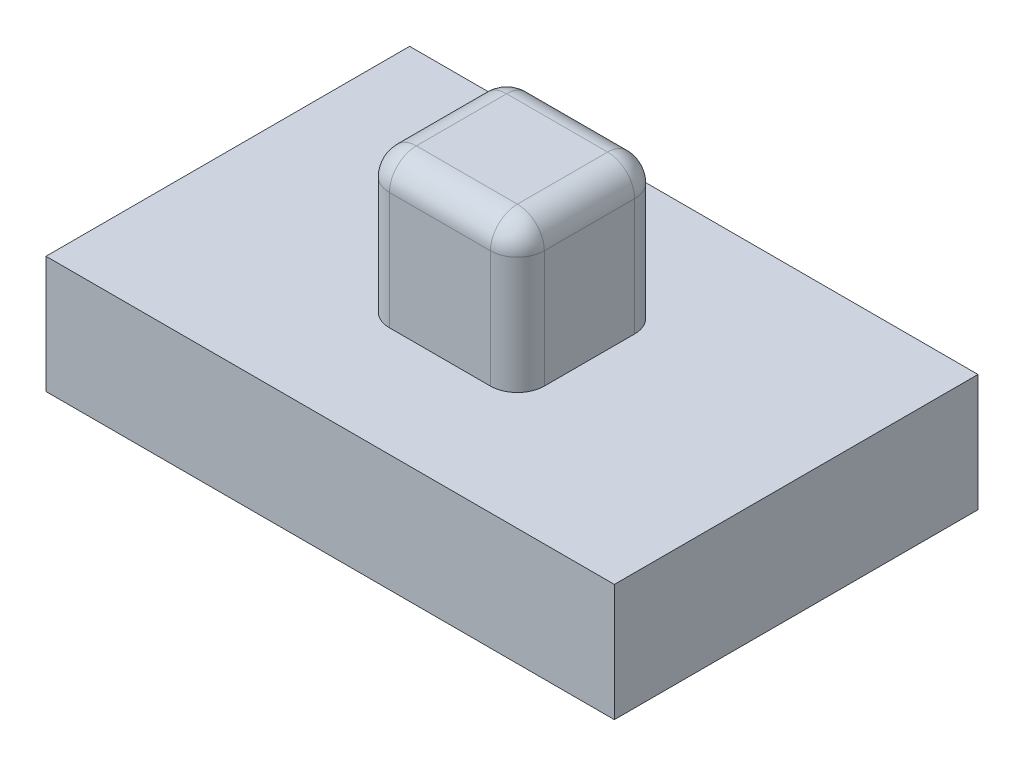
SolidWorks part; units mm, degrees
ref_plane "Front" through (0, 0, 0) normal (0, 0, 1) x (1, 0, 0)
ref_plane "Top" through (0, 0, 0) normal (0, 1, 0) x (1, 0, 0)
ref_plane "Right" through (0, 0, 0) normal (1, 0, 0) x (0, 0, -1)
sketch "Sketch1" plane through (0, 0, 0) normal (0, 1, 0) x (1, 0, 0)
  line L1 (-2.11, -1.35) -> (2.11, -1.35)
  line L2 (-2.11, -1.35) -> (-2.11, 1.35)
  line L3 (-2.11, 1.35) -> (2.11, 1.35)
  line L4 (2.11, -1.35) -> (2.11, 1.35)
  line L5 (-2.11, -1.35) -> (2.11, 1.35) construction
  line L6 (-2.11, 1.35) -> (2.11, -1.35) construction
  point P0 (0, 0)
  dimension "D1" = 4.22
  dimension "D2" = 2.7
extrude "Boss-Extrude1" add sketch "Sketch1" along normal blind 0.87
sketch "Sketch2" plane through (0, 0.87, 0) normal (0, 1, 0) x (1, 0, 0)
  line L1 (-0.575, -0.535) -> (0.575, -0.535)
  line L2 (-0.575, -0.535) -> (-0.575, 0.535)
  line L3 (-0.575, 0.535) -> (0.575, 0.535)
  line L4 (0.575, -0.535) -> (0.575, 0.535)
  line L5 (-0.575, -0.535) -> (0.575, 0.535) construction
  line L6 (-0.575, 0.535) -> (0.575, -0.535) construction
  point P0 (0, 0)
  dimension "D1" = 1.15
  dimension "D2" = 1.07
extrude "Boss-Extrude2" add sketch "Sketch2" along normal blind 1.07
fillet "Fillet1" radius 0.2 8 edges at (0.575, 1.405, -0.535) (-0.575, 1.405, -0.535) (-0.575, 1.405, 0.535) (0.575, 1.405, 0.535) (0, 1.94, 0.535) (-0.575, 1.94, 0) (0, 1.94, -0.535) (0.575, 1.94, 0)
